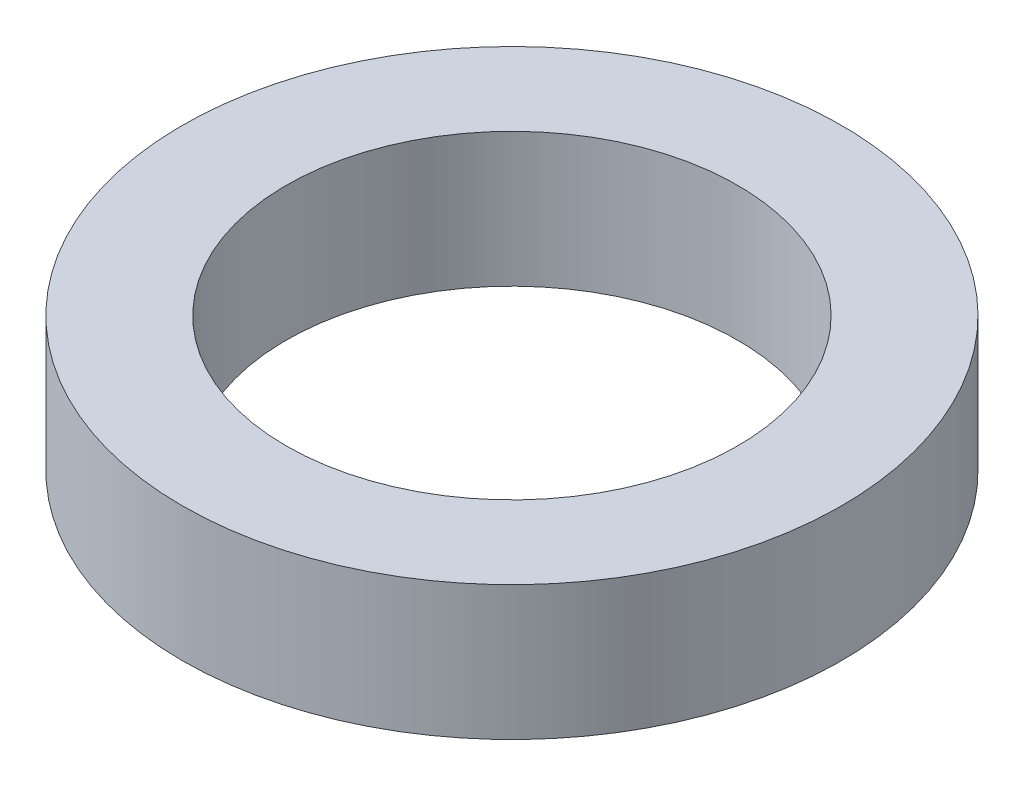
SolidWorks part; units mm, degrees
ref_plane "Front Plane" through (0, 0, 0) normal (0, 0, 1) x (1, 0, 0)
ref_plane "Top Plane" through (0, 0, 0) normal (0, 1, 0) x (1, 0, 0)
ref_plane "Right Plane" through (0, 0, 0) normal (1, 0, 0) x (0, 0, -1)
sketch "Sketch1" plane through (0, 0, 0) normal (0, 1, 0) x (1, 0, 0)
  circle A0 centre (0, 0) radius 3.9751
  circle A1 centre (0, 0) radius 5.8039
  dimension "D1" = 7.9502
  dimension "D2" = 11.6078
extrude "Extrude1" add sketch "Sketch1" along normal blind 2.3622
